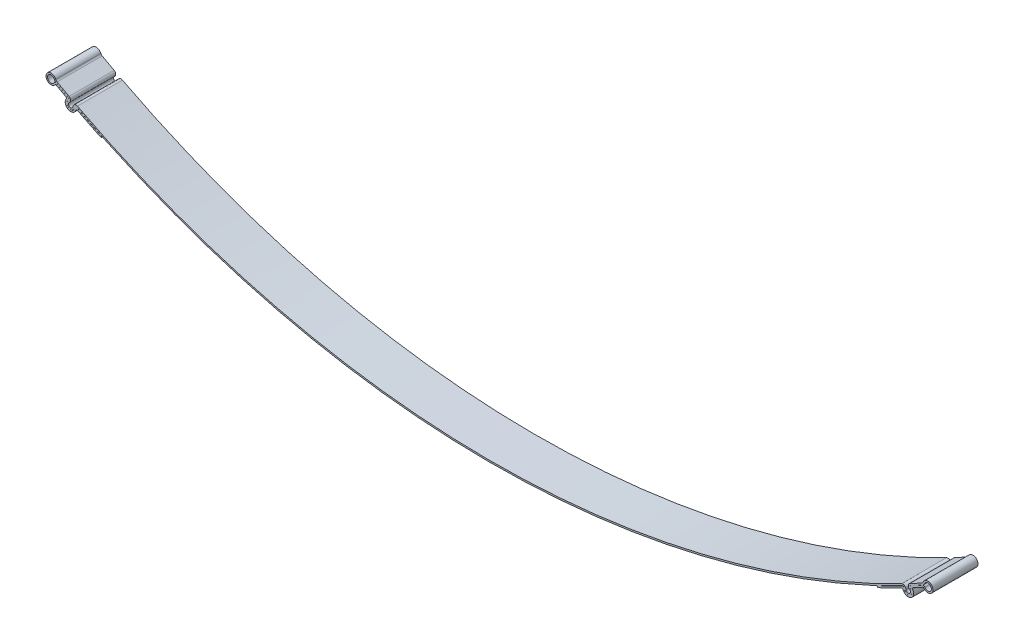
SolidWorks part; units mm, degrees
ref_plane "Front Plane" through (0, 0, 0) normal (0, 0, 1) x (1, 0, 0)
ref_plane "Top Plane" through (0, 0, 0) normal (0, 1, 0) x (1, 0, 0)
ref_plane "Right Plane" through (0, 0, 0) normal (1, 0, 0) x (0, 0, -1)
sketch "Sketch1" plane through (0, 0, 0) normal (0, 0, 1) x (1, 0, 0)
  line L0 (0, 0) -> (493.9284, 0) construction
  line L1 (246.9642, 0) -> (246.9642, -110.406) construction
  line L2 (15.5898, -8.8954) -> (16.2285, -7.649) construction
  line L3 (10.455, -9.4515) -> (12.451, -5.636) construction
  line L4 (12.3171, -6.4561) -> (12.6827, -5.7571) construction
  line L5 (11.0586, -5.7977) -> (11.4252, -5.0968) construction
  line L6 (12.0854, -6.3349) -> (13.5896, -3.4594) construction
  line L7 (11.0586, -5.7977) -> (12.5628, -2.9222) construction
  line L8 (12.3171, -6.4561) -> (13.8213, -3.5806) construction
  line L9 (28.2202, -14.5817) -> (28.6259, -13.7339)
  line L10 (246.9642, -63.5) -> (246.9658, -62.611)
  arc A0 (2.9502, -0.5947) -> (9.6861, -4.2362) centre (247.9006, 444.4483) ccw
  arc A1 (1.8402, 0.734) -> (1.7394, -0.9484) centre (0, 0) ccw
  arc A2 (1.7394, -0.9484) -> (2.9502, -0.5947) centre (2.521, -1.3746) cw
  arc A3 (2.9747, -0.5502) -> (9.7099, -4.1914) centre (247.9006, 444.4483) ccw
  arc A4 (1.8402, 0.734) -> (2.9747, -0.5502) centre (4.1995, 1.675) ccw
  arc A5 (2.9502, -0.5947) -> (493.9284, 0) centre (247.9006, 444.4483) ccw construction
  arc A6 (14.4036, -6.652) -> (246.9642, -63.5) centre (247.9006, 444.4483) ccw
  arc A7 (2.9747, -0.5502) -> (493.9038, 0.0444) centre (247.9006, 444.4483) ccw construction
  arc A8 (14.3803, -6.6972) -> (28.604, -13.7798) centre (247.9006, 444.4483) ccw
  arc A9 (9.7723, -5.5289) -> (13.2681, -7.3615) centre (11.0586, -7.3257) ccw
  arc A10 (14.3803, -6.6972) -> (13.2681, -7.3615) centre (14.03, -7.3739) ccw
  arc A11 (9.7723, -5.5289) -> (9.6861, -4.2362) centre (9.3288, -4.9093) ccw
  arc A12 (9.8019, -5.5702) -> (9.7099, -4.1914) centre (9.3288, -4.9093) ccw
  arc A13 (9.8019, -5.5702) -> (13.2173, -7.3607) centre (11.0586, -7.3257) ccw
  arc A14 (14.4036, -6.652) -> (13.2173, -7.3607) centre (14.03, -7.3739) ccw
  arc A15 (15.0143, -8.0249) -> (28.2202, -14.5817) centre (247.9006, 444.4483) ccw
  arc A16 (2.5216, -1.3735) -> (9.0947, -4.9287) centre (247.9006, 444.4483) ccw construction
  arc A17 (8.503, -5.5732) -> (13.9537, -8.4307) centre (11.0586, -7.3257) ccw
  arc A18 (14.3803, -6.6972) -> (16.2285, -7.649) centre (247.9006, 444.4483) ccw construction
  arc A19 (2.5216, -1.3735) -> (8.2334, -4.47) centre (247.9006, 444.4483) ccw
  arc A20 (2.5199, -1.374) -> (2.5216, -1.3735) centre (2.521, -1.3746) cw
  arc A21 (2.666, 1.0633) -> (2.5199, -1.374) centre (0, 0) ccw
  arc A22 (2.666, 1.0633) -> (3.4034, 0.2286) centre (4.1995, 1.675) ccw
  arc A23 (3.4034, 0.2286) -> (10.1268, -3.4062) centre (247.9006, 444.4483) ccw
  arc A24 (10.3194, -6.293) -> (10.1268, -3.4062) centre (9.3288, -4.9093) ccw
  arc A25 (10.3194, -6.293) -> (12.3284, -7.3463) centre (11.0586, -7.3257) ccw
  arc A26 (14.8123, -5.8625) -> (12.3284, -7.3463) centre (14.03, -7.3739) ccw
  arc A27 (14.8123, -5.8625) -> (246.9658, -62.611) centre (247.9006, 444.4483) ccw
  arc A28 (14.1472, -7.5775) -> (15.823, -8.4402) centre (247.9006, 444.4483) ccw construction
  arc A29 (9.0947, -4.9287) -> (14.1472, -7.5775) centre (11.0586, -7.3257) ccw construction
  arc A30 (15.0143, -8.0249) -> (13.9537, -8.4307) centre (14.6656, -8.7024) ccw
  arc A31 (14.1472, -7.5775) -> (14.1472, -7.5775) centre (14.1472, -7.5775) ccw construction
  arc A32 (8.503, -5.5732) -> (8.2334, -4.47) centre (7.8746, -5.1422) ccw
  arc A33 (9.0947, -4.9287) -> (9.0947, -4.9287) centre (9.0947, -4.9287) ccw construction
  arc A34 (9.7723, -5.5289) -> (13.2681, -7.3615) centre (11.0586, -7.3257) ccw construction
  point P30 (11.6804, -4.8697)
  point P32 (12.6592, -5.8021)
  point P35 (11.4012, -5.1426)
  point P76 (11.6542, -5.105)
  point P81 (0, 0)
  point P82 (11.2323, -5.9108)
  point P83 (0, 0)
  point P84 (11.0538, -7.3349)
  dimension "D2" = 508
  dimension "D3" = 3.9624
  dimension "D7" = 2.54
  dimension "D8" = 31.75
  dimension "D10" = 0.762
  dimension "D5" = 0.762
  dimension "D6" = 1.27
  dimension "D1" = 493.9284
  dimension "D9" = 63.5
  dimension "D4" = 0.889
extrude "Boss-Extrude1" add sketch "Sketch1" along normal mid plane 25.4 contours A32 A17 A30 A15 L9 A8 A10 A9 A11 A0 A2 A1 A4 A3 A12 A13 A14 A6 L10 A27 A26 A25 A24 A23 A22 A21 A20 A19
mirror "Mirror1" about plane through (247.0804, -0.4555, 12.7) normal (-1, 0.0018, 0)
ref_plane "Plane1" through (246.9642, 0, 0) normal (1, 0, 0) x (0, 0, -1)
